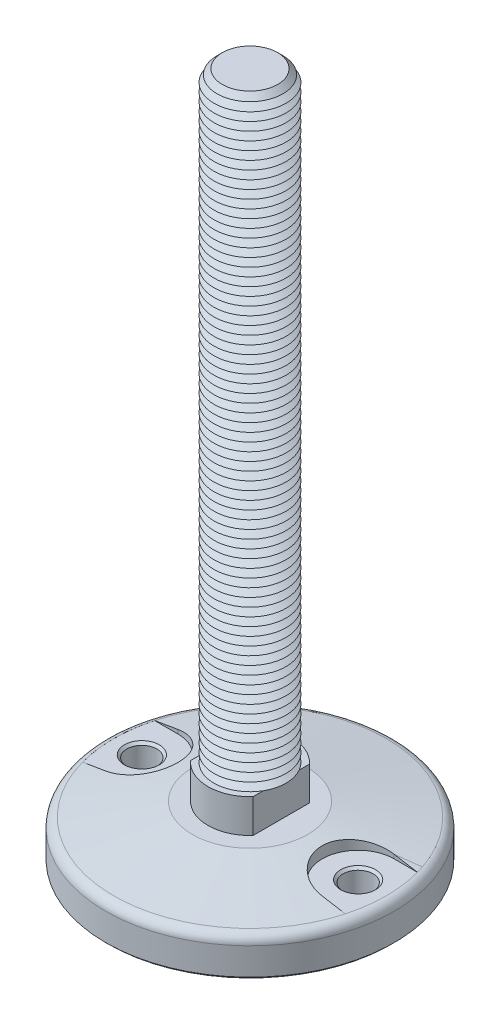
SolidWorks part; units mm, degrees
ref_plane "Front Plane" through (0, 0, 0) normal (0, 0, 1) x (1, 0, 0)
ref_plane "Top Plane" through (0, 0, 0) normal (0, 1, 0) x (1, 0, 0)
ref_plane "Right Plane" through (0, 0, 0) normal (1, 0, 0) x (0, 0, -1)
sketch "Sketch1" plane through (0, 0, 0) normal (1, 0, 0) x (0, 0, -1)
  line L0 (0, 61.3389) -> (0, -58.404) construction
sketch "Sketch2" plane through (0, 0, 0) normal (1, 0, 0) x (0, 0, -1)
  line L0 (0, 0) -> (-24, 0)
  line L1 (-24, 0) -> (-60, -6.3478)
  line L2 (-60, -6.3478) -> (-60, -22)
  line L3 (-60, -22) -> (0, -22)
  line L4 (0, 61.3389) -> (0, -58.404) construction
  line L5 (0, -22) -> (0, 0)
  dimension "D1" = 22
  dimension "D2" = 60
  dimension "D3" = 24
  dimension "D4" = 10
revolve "Revolve1" add sketch "Sketch2" angle 360 about L0
fillet "Fillet1" radius 4 1 edges at (0, -6.3478, 60)
sketch "Sketch3" plane through (0, 0, 0) normal (0, 1, 0) x (1, 0, 0)
  circle A0 centre (0, 0) radius 17.5
  dimension "D1" = 35
extrude "Boss-Extrude1" add sketch "Sketch3" along normal blind 14
sketch "Sketch4" plane through (0, 14, 0) normal (0, 1, 0) x (1, 0, 0)
  line L0 (-13, 11.7154) -> (-13, -11.7154)
  line L2 (13, -11.7154) -> (13, 11.7154)
  arc A0 (-13, 11.7154) -> (-13, -11.7154) centre (0, 0) ccw
  circle A1 centre (0, 0) radius 17.5 construction
  arc A2 (13, -11.7154) -> (13, 11.7154) centre (0, 0) ccw
  dimension "D1" = 26
extrude "Cut-Extrude1" cut sketch "Sketch4" against normal blind 14
sketch "Sketch5" plane through (0, 14, 0) normal (0, 1, 0) x (1, 0, 0)
  circle A0 centre (0, 0) radius 15
  dimension "D1" = 30
extrude "Boss-Extrude2" add sketch "Sketch5" along normal blind 250
chamfer "Chamfer1" distance 3.5 angle 45 1 edges at (0, 264, 15)
sketch "Sketch6" plane through (0, 0, 0) normal (1, 0, 0) x (0, 0, -1)
  line L0 (-15, 14) -> (-11.9689, 15.75)
  line L1 (-11.9689, 15.75) -> (-15, 17.5)
  line L2 (-15, 260.5) -> (-15, 14) construction
  line L3 (-15, 17.5) -> (-15, 14)
  dimension "D1" = 3.5
revolve "Cut-Revolve1" cut sketch "Sketch6" angle 360 about L0
pattern_linear "LPattern1" count 71 spacing 3.5 along (0, 1, 0) of "Cut-Revolve1"
sketch "Sketch8" plane through (0, 0, 0) normal (0, 1, 0) x (1, 0, 0)
  line L0 (-45, 15) -> (-54.6743, 15)
  line L1 (-45, -15) -> (-54.6743, -15)
  arc A1 (-54.6743, 15) -> (-54.6743, -15) centre (0, 0) ccw
  circle A2 centre (0, 0) radius 56.6946 construction
  arc A3 (-45, -15) -> (-45, 15) centre (-45, 0) ccw
  point P3 (-45, 0)
  point P11 (0, 0)
  dimension "D1" = 45
  dimension "D2" = 30
extrude "Cut-Extrude4" cut sketch "Sketch8" against normal blind 5.79
sketch "Sketch10" plane through (0, -5.79, 0) normal (0, 1, 0) x (1, 0, 0)
  circle A0 centre (-45, 0) radius 6.25
  dimension "D1" = 12.5
extrude "Cut-Extrude5" cut sketch "Sketch10" against normal up to surface (16.21 mm away)
chamfer "Chamfer2" distance 1 angle 45 2 edges at (-45, -22, -6.25) (-45, -5.79, 6.25)
mirror "Mirror1" about plane through (0, 0, 0) normal (1, 0, 0) of "Chamfer2", "Cut-Extrude5", "Cut-Extrude4"
chamfer "Chamfer3" distance 1 angle 45 1 edges at (0, -22, 60)
